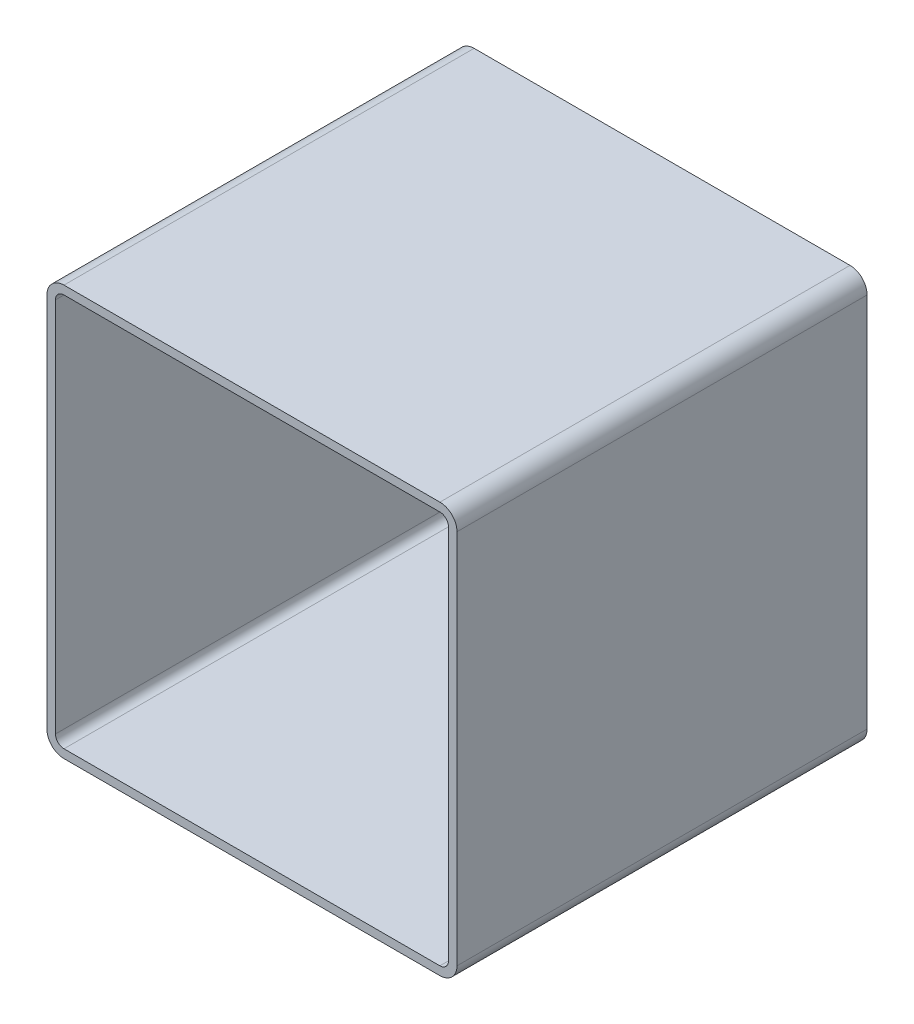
SolidWorks part; units mm, degrees
ref_plane "Front Plane" through (0, 0, 0) normal (0, 0, 1) x (1, 0, 0)
ref_plane "Top Plane" through (0, 0, 0) normal (0, 1, 0) x (1, 0, 0)
ref_plane "Right Plane" through (0, 0, 0) normal (1, 0, 0) x (0, 0, -1)
sketch "Sketch1" plane through (0, 0, 0) normal (0, 0, 1) x (1, 0, 0)
sketch_block_instance "HSS12x12x0.250-1"
sketch_block "HSS12x12x0.250"
extrude "Boss-Extrude1" add sketch "Sketch1" along normal blind 304.8
